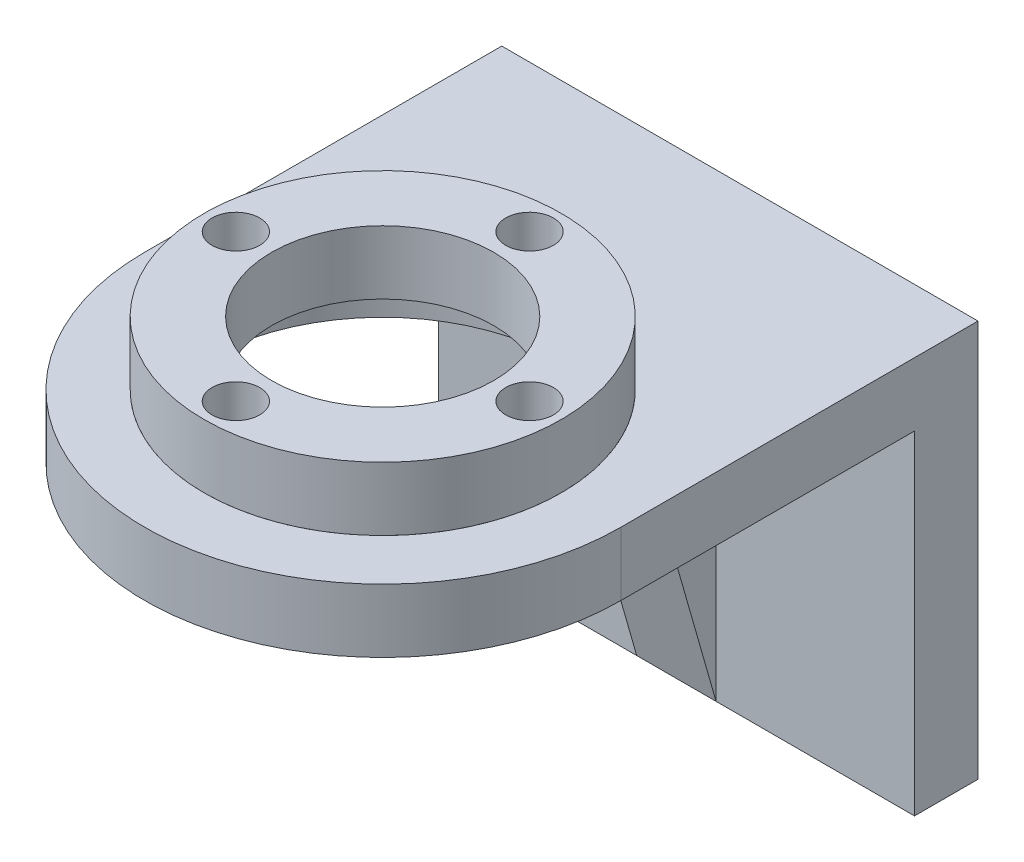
SolidWorks part; units mm, degrees
ref_plane "前视基准面" through (0, 0, 0) normal (0, 0, 1) x (1, 0, 0)
ref_plane "上视基准面" through (0, 0, 0) normal (0, 1, 0) x (1, 0, 0)
ref_plane "右视基准面" through (0, 0, 0) normal (1, 0, 0) x (0, 0, -1)
sketch "草图1" plane through (0, 0, 0) normal (0, 0, 1) x (1, 0, 0)
  line L1 (-30, 21) -> (30, 21)
  line L2 (-30, 21) -> (-30, -21)
  line L3 (-30, -21) -> (30, -21)
  line L4 (30, 21) -> (30, -21)
  line L5 (-30, 21) -> (30, -21) construction
  line L6 (-30, -21) -> (30, 21) construction
  point P0 (0, 0)
  dimension "D1" = 42
  dimension "D2" = 60
extrude "凸台-拉伸1" add sketch "草图1" along normal blind 8
sketch "草图2" plane through (0, 21, 0) normal (0, 1, 0) x (1, 0, 0)
  line L0 (30, 0) -> (-30, 0)
  line L1 (30, 0) -> (30, -45)
  line L2 (-30, 0) -> (-30, -45)
  arc A0 (30, -45) -> (-30, -45) centre (0, -45) cw
  dimension "D1" = 45
extrude "凸台-拉伸2" add sketch "草图2" along normal blind 8
sketch "草图3" plane through (0, 21, 0) normal (0, -1, 0) x (1, 0, 0)
  circle A0 centre (0, 45) radius 22.5
  dimension "D1" = 45
extrude "切除-拉伸1" cut sketch "草图3" against normal through all
sketch "草图5" plane through (0, 29, 0) normal (0, 1, 0) x (1, 0, 0)
  circle A0 centre (0, -45) radius 22.5 construction
  circle A1 centre (0, -45) radius 22.5
extrude "凸台-拉伸4" add sketch "草图5" along normal blind 8 separate body contours A1
sketch "草图11" plane through (0, 29, 0) normal (0, -1, 0) x (1, 0, 0)
  circle A0 centre (0, 45) radius 14
  dimension "D1" = 28
extrude "切除-拉伸4" cut sketch "草图11" against normal through all
sketch "草图12" plane through (0, 29, 0) normal (0, -1, 0) x (1, 0, 0)
  line L2 (-30, 0) -> (30, 0) construction
  circle A0 centre (0, 26.5) radius 3
  circle A1 centre (-18.5, 45) radius 3
  circle A2 centre (0, 63.5) radius 3
  circle A3 centre (18.5, 45) radius 3
  point P14 (0, 45)
  dimension "D2" = 6
  dimension "D1" = 26.5
  dimension "D3" = 4
extrude "切除-拉伸5" cut sketch "草图12" against normal through all
sketch "草图8" plane through (0, 0, 0) normal (1, 0, 0) x (0, 0, -1)
  line L0 (-8, -21) -> (-20, 21)
  line L2 (-8, 21) -> (-8, -21) construction
  line L3 (-45, 21) -> (-8, 21) construction
  dimension "D1" = 12
  dimension "D2" = 0
rib "筋1" sketch "草图8" sketch "草图8" thickness 10 extrusion direction parallel to sketch draft on no parameters "D1"=10
other "孔1"
sketch "草图13" plane through (0, 0, 8) normal (0, 0, 1) x (1, 0, 0)
  line L0 (-30, -21) -> (-5, -21) construction
  line L1 (-30, 21) -> (-30, -21) construction
  circle A0 centre (-20, -11) radius 6
  dimension "D1" = 12
  dimension "D2" = 10
  dimension "D3" = 10
